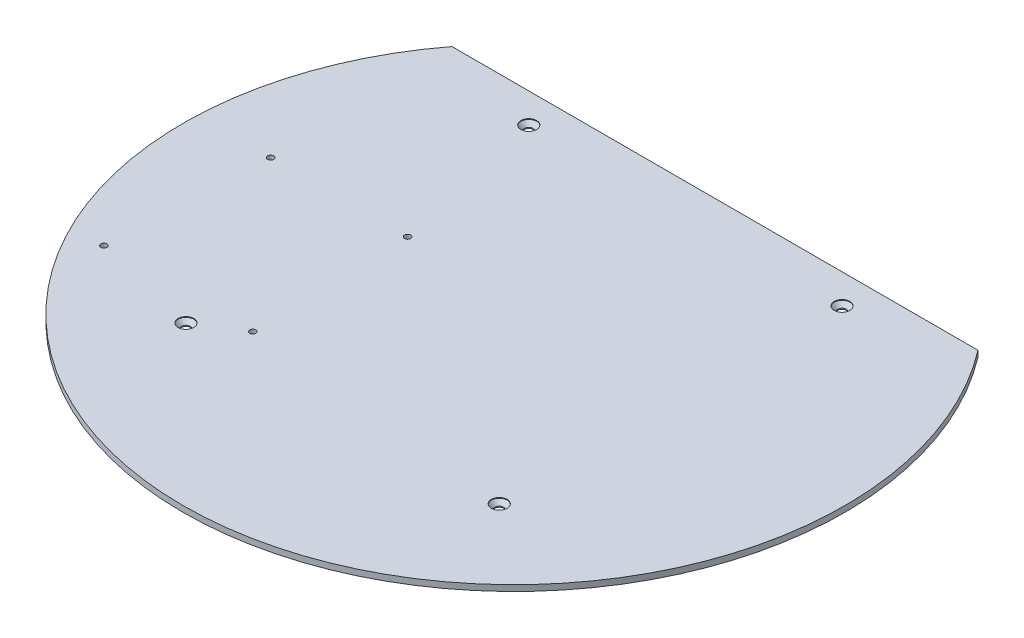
SolidWorks part; units mm, degrees
ref_plane "Front" through (0, 0, 0) normal (0, 0, 1) x (1, 0, 0)
ref_plane "Top" through (0, 0, 0) normal (0, 1, 0) x (1, 0, 0)
ref_plane "Right" through (0, 0, 0) normal (1, 0, 0) x (0, 0, -1)
sketch "Sketch1" plane through (0, 0, 0) normal (0, 1, 0) x (1, 0, 0)
  line L0 (141.2786, 107.95) -> (-141.2786, 107.95)
  arc A0 (-141.2786, 107.95) -> (141.2786, 107.95) centre (0, 0) ccw
  dimension "D1" = 355.6
  dimension "D2" = 107.95
extrude "Extrude1" add sketch "Sketch1" along normal blind 3.175
hole_wizard "CSK for #8 Flat Head Machine Screw1" positions "Sketch6" profile "Sketch5" countersink size "#8" standard "Ansi Inch"
sketch "Sketch6" plane through (0, 3.175, 0) normal (0, 1, 0) x (-1, 0, 0)
  point P0 (84.1375, -92.075)
  point P1 (-84.1375, -92.075)
  point P3 (-84.1375, 92.075)
  point P5 (84.1375, 92.075)
  dimension "D1" = 92.075
  dimension "D2" = 92.075
  dimension "D3" = 84.1375
  dimension "D4" = 84.1375
sketch "Sketch5" plane through (-84.1375, 3.175, -92.075) normal (1, 0, 0) x (0, 0, 1)
  line L0 (0, 0) -> (0, 3.175)
  line L1 (0, 3.175) -> (2.2479, 3.175)
  line L2 (2.2479, 3.175) -> (2.2479, 2.6455)
  line L3 (2.2479, 2.6455) -> (4.2164, 0.381)
  line L4 (4.2164, 0.381) -> (4.2164, 0)
  line L6 (4.2164, 0) -> (0, 0)
  line L7 (-2.2479, 2.6455) -> (-4.2164, 0.381) construction
  line L11 (0, -6.35) -> (0, 107.95) construction
  dimension "Thru Hole Dia." = 4.4958
  dimension "Thru Hole Depth" = 3.175
  dimension "C'Sink Dia." = 8.4328
  dimension "C'Sink Angle" = 82
  dimension "Head Clearance" = 0.381
sketch "Sketch4" plane through (-209.0954, 3.175, 39.1921) normal (0, 1, 0) x (1, 0, 0)
  line L0 (152.0412, -44.0264) -> (61.8712, 51.8586) construction
  line L1 (61.8712, 51.8586) -> (152.0412, 51.8586) construction
  line L2 (61.8712, 51.8586) -> (61.8712, -44.0264) construction
  line L3 (61.8712, -44.0264) -> (152.0412, -44.0264) construction
  line L4 (152.0412, 51.8586) -> (152.0412, -44.0264) construction
  line L5 (69.2511, -30.1718) -> (150.9663, -30.1718) construction
  line L6 (150.9663, -30.1718) -> (150.9663, -35.0062) construction
  line L7 (150.9663, -35.0062) -> (140.7112, -35.0062) construction
  line L8 (140.7112, -35.0062) -> (140.7112, -40.3373) construction
  line L9 (140.7112, -40.3373) -> (89.25, -40.3373) construction
  line L10 (89.25, -40.3373) -> (89.25, -44.1657) construction
  line L11 (89.25, -44.1657) -> (69.2511, -44.1657) construction
  line L12 (69.2511, -44.1657) -> (69.2511, -30.1718) construction
  circle A0 centre (66.9512, -38.9464) radius 1.651
  circle A1 centre (146.9612, -38.9464) radius 1.651
  circle A2 centre (70.7612, 46.7786) radius 1.651
  circle A3 centre (144.4212, 46.7786) radius 1.651
  dimension "D5" = 3.302
  dimension "D12" = 5.08
  dimension "D1" = 95.885
  dimension "D2" = 80.01
  dimension "D3" = 73.66
  dimension "D4" = 85.725
  dimension "D6" = 85.09
  dimension "D7" = 82.55
  dimension "D8" = 7.62
  dimension "D9" = 8.89
  dimension "D10" = 5.08
  dimension "D11" = 5.08
  dimension "D13" = 3.6892
  dimension "D18" = 81.7152
  dimension "D20" = 10.1655
  dimension "D21" = 19.9989
  dimension "D22" = 10.2551
  dimension "D23" = 4.8344
extrude "PC104 Pattern" cut sketch "Sketch4" against normal through all
